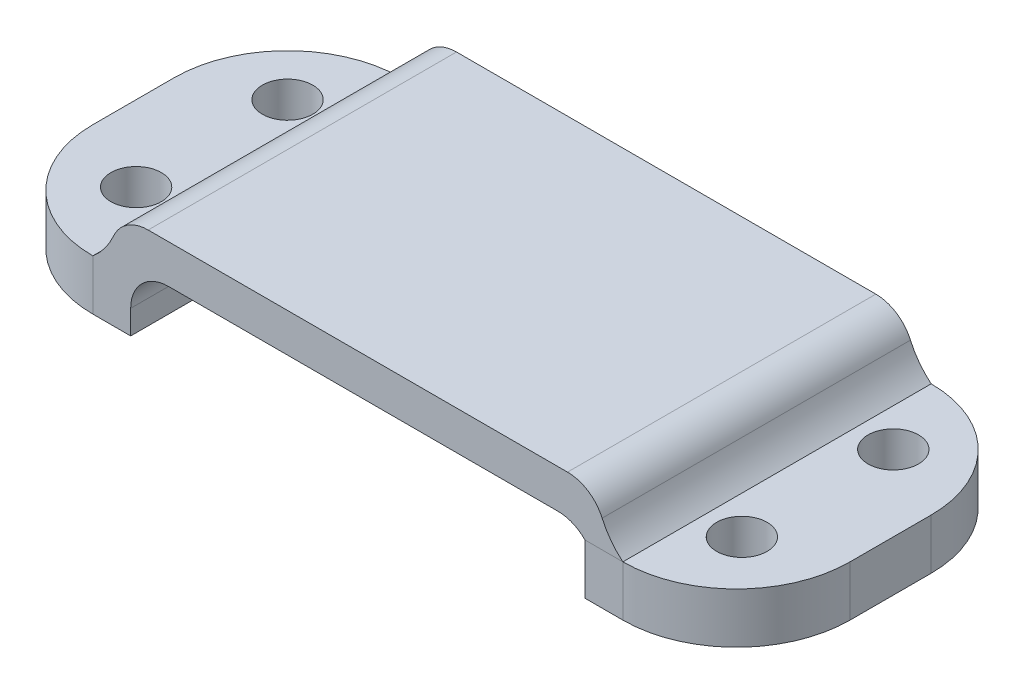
SolidWorks part; units mm, degrees
ref_plane "Front Plane" through (0, 0, 0) normal (0, 0, 1) x (1, 0, 0)
ref_plane "Top Plane" through (0, 0, 0) normal (0, 1, 0) x (1, 0, 0)
ref_plane "Right Plane" through (0, 0, 0) normal (1, 0, 0) x (0, 0, -1)
sketch "Sketch2" plane through (0, 0, 0) normal (0, 1, 0) x (1, 0, 0)
  line L0 (-18, 12.215) -> (-30, 12.215)
  line L1 (30, -12.215) -> (18, -12.215)
  line L2 (30, -12.215) -> (30, 12.215)
  line L3 (30, 12.215) -> (18, 12.215)
  line L4 (-30, -12.215) -> (-30, 12.215)
  line L5 (30, -12.215) -> (18, -7.329) construction
  line L6 (30, 12.215) -> (18, 7.329) construction
  line L7 (-30, 12.215) -> (-18, 12.215)
  line L8 (-30, 12.215) -> (-30, -12.215)
  line L9 (-30, -12.215) -> (-18, -12.215)
  line L10 (-18, 12.215) -> (-18, -12.215)
  line L11 (30, 12.215) -> (18, 12.215)
  line L12 (30, 12.215) -> (30, -12.215)
  line L13 (30, -12.215) -> (18, -12.215)
  line L14 (18, 12.215) -> (18, -12.215)
  line L15 (0, 0) -> (-30, -12.215) construction
  line L16 (0, 0) -> (-30, 12.215) construction
  line L17 (-18, -12.215) -> (-30, -12.215)
  point P0 (0, 0)
extrude "Boss-Extrude1" add sketch "Sketch2" along normal blind 4 contours L10 L0 L4 L9 | L3 L14 L1 L2
sketch "Sketch3" plane through (0, 4, 0) normal (0, 1, 0) x (1, 0, 0)
  line L0 (-18, 12.215) -> (-30, 12.215) construction
  circle A0 centre (-24, 6.215) radius 2
  circle A1 centre (24, 6.215) radius 2
  circle A2 centre (24, -5.785) radius 2
  circle A3 centre (-24, -5.785) radius 2
  dimension "D1" = 6
  dimension "D2" = 2
  dimension "D3" = 2
extrude "Cut-Extrude1" cut sketch "Sketch3" against normal blind 4
fillet "Fillet1" radius 9 2 edges at (-30, 2, 12.215) (-30, 2, -12.215)
fillet "Fillet2" radius 9 2 edges at (30, 2, -12.215) (30, 2, 12.215)
sketch "Sketch4" plane through (0, 0, 0) normal (0, 0, 1) x (1, 0, 0)
  line L5 (-21, 4) -> (-19.6147, 4.9)
  line L6 (-18, 4) -> (-21, 4)
  line L7 (-18, 4) -> (-18, 4.9)
  line L8 (-18, 4.9) -> (-19.6147, 4.9)
  line L11 (-18, 4.9) -> (-19.6147, 4.9)
  line L12 (-18, 4.9) -> (-18, 7.9654)
  line L13 (-18, 7.9654) -> (-19.6147, 7.9654)
  line L14 (-19.6147, 4.9) -> (-19.6147, 7.9654)
  line L15 (-18, 7.9654) -> (0, 7.9654)
  line L16 (-18, 7.9654) -> (-18, 4.9)
  line L17 (-18, 4.9) -> (0, 4.9)
  line L18 (0, 7.9654) -> (0, 4.9)
  point P2 (-19.6038, 8.522)
  point P5 (-19.6147, 8.9346)
  point P12 (-18, 8.7827)
  point P13 (-18, 8.5359)
  point P14 (-18, 8.422)
extrude "Boss-Extrude2" add sketch "Sketch4" along normal up to surface and the other way up to surface contours L18 L15 L12 L17 | L14 L8 L12 L13 | L7 L8 L5 L6
mirror "Mirror1" about plane through (0, 0, 0) normal (1, 0, 0) of "Boss-Extrude2"
fillet "Fillet3" radius 3 4 edges at (19.6147, 7.9654, 0) (-19.6147, 7.9654, 0) (18, 4.9, 0) (-18, 4.9, 0)
fillet "Fillet4" radius 6 2 edges at (19.6147, 4.9, 0) (-19.6147, 4.9, 0)
